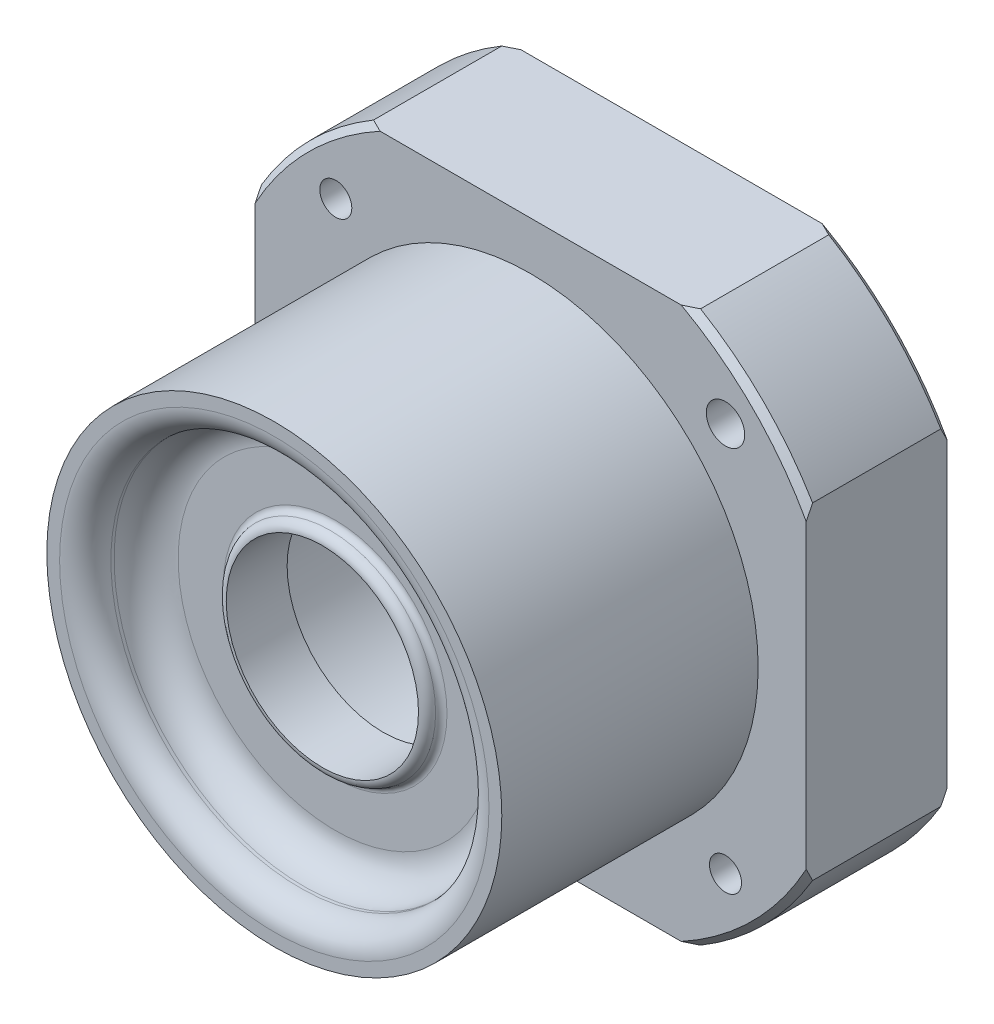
SolidWorks part; units mm, degrees
ref_plane "Face" through (0, 0, 0) normal (0, 0, 1) x (1, 0, 0)
ref_plane "Dessus" through (0, 0, 0) normal (0, 1, 0) x (1, 0, 0)
ref_plane "Droite" through (0, 0, 0) normal (1, 0, 0) x (0, 0, -1)
sketch "Esquisse1" plane through (0, 0, 0) normal (0, 0, 1) x (1, 0, 0)
  circle A0 centre (0, 0) radius 35.5
  dimension "D1" = 71
extrude "Base-Extrusion" add sketch "Esquisse1" along normal blind 40
sketch "Esquisse2" plane through (0, 0, 40) normal (0, 0, 1) x (1, 0, 0)
  circle A0 centre (0, 0) radius 29.5
  dimension "D1" = 59
extrude "Enlèv. mat.-Extru.1" cut sketch "Esquisse2" against normal blind 9.5
fillet "Congé1" radius 4
fillet "Congé2" radius 5
sketch "Esquisse3" plane through (0, 0, 30.5) normal (0, 0, 1) x (1, 0, 0)
  circle A0 centre (0, 0) radius 16.5
  dimension "D1" = 33
extrude "Boss.-Extru.1" add sketch "Esquisse3" along normal blind 2
fillet "Congé3" radius 1.5
sketch "Esquisse4" plane through (0, 0, 0) normal (0, 0, -1) x (-1, 0, 0)
  circle A0 centre (0, 0) radius 50
  dimension "D1" = 100
extrude "Boss.-Extru.2" add sketch "Esquisse4" along normal blind 22
chamfer "Chanfrein1" distance 1 angle 45
sketch "Esquisse5" plane through (0, 0, -22) normal (0, 0, -1) x (-1, 0, 0)
  circle A0 centre (0, 0) radius 15
  dimension "D1" = 30
extrude "Enlèv. mat.-Extru.2" cut sketch "Esquisse5" against normal through all
sketch "Esquisse6" plane through (0, 0, -22) normal (0, 0, -1) x (-1, 0, 0)
  circle A0 centre (0, 0) radius 20
  dimension "D1" = 40
extrude "Enlèv. mat.-Extru.3" cut sketch "Esquisse6" against normal blind 45
sketch "Esquisse7" plane through (0, 0, 0) normal (0, 0, 1) x (1, 0, 0)
  line L0 (-36.6966, 43) -> (30.7053, 43)
  dimension "D1" = 43
extrude "Enlèv. mat.-Extru.4" cut sketch "Esquisse7" against normal through all and the other way through all
sketch "Esquisse8" plane through (0, 0, 0) normal (0, 0, 1) x (1, 0, 0)
  line L0 (-43, 36.7715) -> (-43, -40.3663)
  dimension "D1" = 43
extrude "Enlèv. mat.-Extru.5" cut sketch "Esquisse8" against normal through all and the other way through all flip side to cut
sketch "Esquisse9" plane through (0, 0, 0) normal (0, 0, 1) x (1, 0, 0)
  line L0 (43, 37.2209) -> (43, -47.5558)
  dimension "D1" = 43
extrude "Enlèv. mat.-Extru.6" cut sketch "Esquisse9" against normal through all and the other way through all
sketch "Esquisse10" plane through (0, 0, 0) normal (0, 0, 1) x (1, 0, 0)
  line L0 (-38.494, -43) -> (42.8377, -43)
  dimension "D1" = 43
extrude "Enlèv. mat.-Extru.7" cut sketch "Esquisse10" against normal through all and the other way through all flip side to cut
hole_wizard "Trou taraudé M6x1.01" positions "Esquisse13" profile "Esquisse12" tap size "M6x1.0" standard "ISO"
sketch "Esquisse13" plane through (0, 0, 0) normal (0, 0, 1) x (1, 0, 0)
  line L0 (0, 0) -> (-30.4056, 30.4056) construction
  line L1 (0, 0) -> (0, 50.1725) construction
  point P0 (-30.4056, 30.4056)
  dimension "D1" = 45
  dimension "D2" = 43
sketch "Esquisse12" plane through (-30.4056, 30.4056, 0) normal (1, 0, 0) x (0, -1, 0)
  line L0 (0, 0) -> (0, 22)
  line L1 (0, 22) -> (2.5, 22)
  line L2 (2.5, 22) -> (2.5, 0)
  line L5 (2.5, 0) -> (0, 0)
  line L11 (0, -6.35) -> (0, 107.95) construction
  dimension "Diamètre du perçage jusqu'au prochain" = 5
  dimension "Profondeur du perçage jusqu'au prochain" = 22
pattern_circular "Répétition circulaire1" count 2 every 180
sketch "Esquisse14" plane through (0, 0, 0) normal (0, 0, 1) x (1, 0, 0)
  line L0 (0, 0) -> (30.4056, 30.4056) construction
  line L1 (0, 0) -> (0, 51.0742) construction
  circle A0 centre (30.4056, 30.4056) radius 3
  dimension "D1" = 6
  dimension "D2" = 45
  dimension "D3" = 43
extrude "Enlèv. mat.-Extru.8" cut sketch "Esquisse14" against normal through all
pattern_circular "Répétition circulaire2" count 2 every 180
fillet "Congé4" radius 1
sketch "Esquisse15" plane through (0, 0, 0) normal (0, 0, 1) x (1, 0, 0)
  circle A0 centre (0, 0) radius 55
  dimension "D1" = 110
extrude "Boss.-Extru.3" add sketch "Esquisse15" along normal up to surface (40 mm away)
sketch "Esquisse17" plane through (0, 0, 0) normal (0, 0, 1) x (1, 0, 0)
  circle A0 centre (0, 0) radius 52.5
  circle A1 centre (0, 0) radius 15
  dimension "D1" = 105
extrude "Boss.-Extru.4" add sketch "Esquisse17" along normal up to surface (40 mm away)
sketch "Esquisse19" plane through (0, 0, -20) normal (0, 0, -1) x (-1, 0, 0)
  circle A0 centre (0, 0) radius 20 construction
  circle A1 centre (0, 0) radius 20
extrude "Enlèv. mat.-Extru.9" cut sketch "Esquisse19" against normal blind 45
sketch "Esquisse20" plane through (0, 0, 40) normal (0, 0, 1) x (1, 0, 0)
  arc A0 (43, 25.5147) -> (25.5147, 43) centre (0, 0) ccw construction
  point P0 (0, 0)
